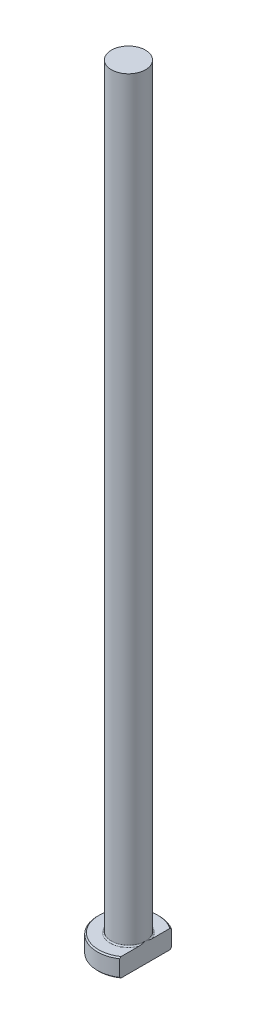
SolidWorks part; units mm, degrees
ref_plane "Front Plane" through (0, 0, 0) normal (0, 0, 1) x (1, 0, 0)
ref_plane "Top Plane" through (0, 0, 0) normal (0, 1, 0) x (1, 0, 0)
ref_plane "Right Plane" through (0, 0, 0) normal (1, 0, 0) x (0, 0, -1)
sketch "Sketch1" plane through (0, 0, 0) normal (0, 0, 1) x (1, 0, 0)
  line L0 (0, 259.9588) -> (0, -15.1925) construction
  line L1 (0, 0) -> (-5, 0)
  line L2 (-5, 0) -> (-5, 3)
  line L3 (-5, 3) -> (-2.75, 3)
  line L4 (-2.75, 3) -> (-2.75, 125)
  line L5 (-2.75, 125) -> (0, 125)
  line L6 (0, 125) -> (0, 0)
  dimension "L" = 125
  dimension "H" = 10
  dimension "T" = 3
  dimension "D" = 5.5
revolve "Revolve1" add sketch "Sketch1" angle 360 about L0
chamfer "Chamfer1" distance 0.2 angle 45 2 edges at (0, 3, 5) (0, 0, 5)
fillet "Fillet1" radius 0.2 1 edges at (0, 3, 2.75)
sketch "Sketch2" plane through (0, 0, 0) normal (0, 1, 0) x (1, 0, 0)
  line L0 (2.75, 4.1758) -> (2.75, -4.1758)
  circle A0 centre (0, 0) radius 5 construction
  arc A1 (2.75, -4.1758) -> (2.75, 4.1758) centre (0, 0) ccw
  circle A2 centre (0, 0) radius 2.75 construction
extrude "KEY" cut sketch "Sketch2" along normal through all
